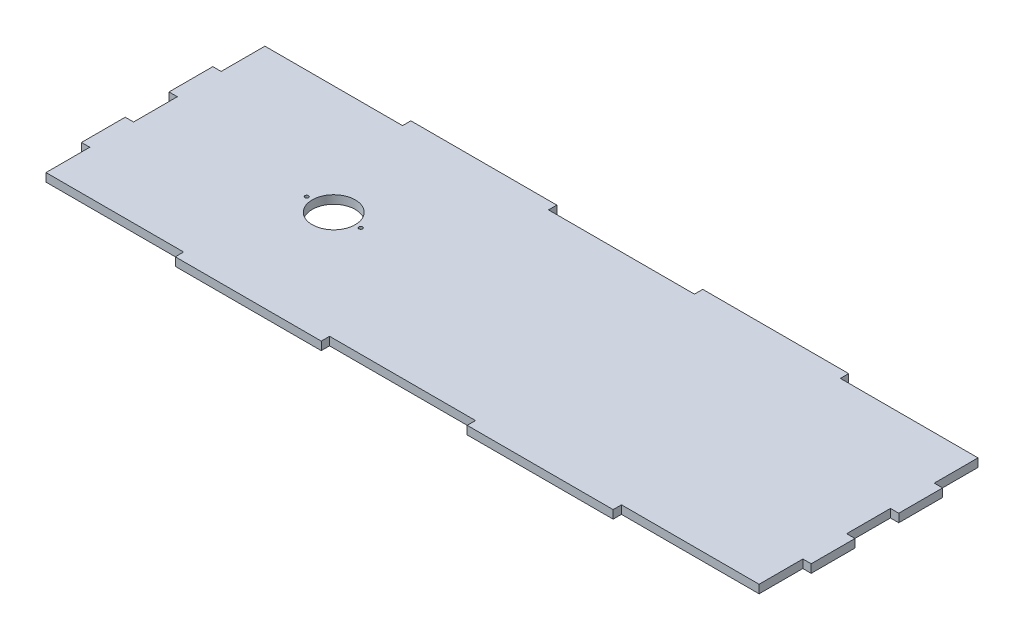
SolidWorks part; units mm, degrees
ref_plane "Alzado" through (0, 0, 0) normal (0, 0, 1) x (1, 0, 0)
ref_plane "Planta" through (0, 0, 0) normal (0, 1, 0) x (1, 0, 0)
ref_plane "Vista lateral" through (0, 0, 0) normal (1, 0, 0) x (0, 0, -1)
sketch "Sketch1" plane through (0, 0, 0) normal (0, 1, 0) x (1, 0, 0)
  line L17 (-20, 30) -> (20, 30)
  line L32 (20, -30) -> (-20, -30)
  line L40 (-100, 30) -> (-60, 30)
  line L41 (-60, 30) -> (-60, 32.28)
  line L42 (-60, 32.28) -> (-20, 32.28)
  line L43 (-20, 32.28) -> (-20, 30)
  line L44 (20, 30) -> (20, 32.28)
  line L45 (20, 32.28) -> (60, 32.28)
  line L46 (60, 32.28) -> (60, 30)
  line L48 (-60, -30) -> (-60, -32.28)
  line L49 (-60, -32.28) -> (-20, -32.28)
  line L50 (-20, -32.28) -> (-20, -30)
  line L51 (20, -30) -> (20, -32.28)
  line L52 (20, -32.28) -> (60, -32.28)
  line L53 (60, -32.28) -> (60, -30)
  line L54 (-100, 30) -> (-97.72, 30)
  line L55 (-97.72, 30) -> (-97.72, 18)
  line L56 (-97.72, 18) -> (-100, 18)
  line L57 (-100, 6) -> (-97.72, 6)
  line L58 (-97.72, 6) -> (-97.72, -6)
  line L59 (-97.72, -6) -> (-100, -6)
  line L60 (-100, -6) -> (-100, -18)
  line L61 (-100, -18) -> (-97.72, -18)
  line L62 (-97.72, -18) -> (-97.72, -30)
  line L64 (97.72, 30) -> (97.72, 18)
  line L65 (97.72, 18) -> (100, 18)
  line L66 (100, 6) -> (97.72, 6)
  line L67 (97.72, 6) -> (97.72, -6)
  line L68 (97.72, -6) -> (100, -6)
  line L69 (100, -18) -> (97.72, -18)
  line L70 (97.72, -18) -> (97.72, -30)
  line L71 (60, 30) -> (97.72, 30)
  line L72 (100, 18) -> (100, 5.3423)
  line L73 (100, -6) -> (100, -18)
  line L74 (60, -30) -> (97.72, -30)
  line L75 (-97.72, -30) -> (-60, -30)
  line L76 (-100, 18) -> (-100, 6)
  point P0 (0, 0)
  point P5 (-60, 30)
  point P6 (-20, 30)
  point P8 (20, 30)
  point P9 (60, 30)
  point P10 (-60, -30)
  point P11 (-20, -30)
  point P12 (20, -30)
  point P13 (60, -30)
  point P14 (-100, 18)
  point P15 (-100, 6)
  point P16 (-100, -6)
  point P17 (-100, -18)
  point P18 (100, 18)
  point P19 (100, 6)
  point P20 (100, -6)
  point P21 (100, -18)
extrude "Boss-Extrude3" add sketch "Sketch1" along normal blind 2.28 contours L56 L76 L57 L58 L59 L60 L61 L62 L75 L48 L49 L50 L32 L51 L52 L53 L74 L70 L69 L73 L68 L67 L66 L72 L65 L64 L71 L46 L45 L44 L17 L43 L42 L41 L40 L55
sketch "Sketch2" plane through (0, 2.28, 0) normal (0, 1, 0) x (1, 0, 0)
  line L0 (0, 0) -> (-97.72, 0)
  line L1 (-97.72, 6) -> (-97.72, -6) construction
  circle A0 centre (-48.86, 0) radius 5.9
  circle A1 centre (-56.26, 0) radius 0.5
  circle A2 centre (-41.46, 0) radius 0.5
  point P5 (-48.86, 0)
  point P10 (-55.76, 0)
  point P11 (-54.76, 0)
  point P14 (-42.96, 0)
  point P15 (-41.96, 0)
extrude "Cut-Extrude2" cut sketch "Sketch2" against normal blind 10 contours L0 A0 | L0 A0 | L0 A2 | L0 A2 | L0 A1 | L0 A1
equation "\"largo\"= 200"
equation "\"ancho\"= 60mm"
equation "\"madera\"= 2.28mm"
equation "\"buzzer\"= 11.8mm"
equation "\"distancia\"= 1mm"
equation "\"tornillo\"= 1mm"
equation "\"D1@Sketch2\"=\"buzzer\""
equation "\"D2@Sketch2\"=\"tornillo\""
equation "\"D3@Sketch2\"=\"distancia\""
equation "\"D4@Sketch2\"=\"tornillo\""
equation "\"D5@Sketch2\"=\"distancia\""
